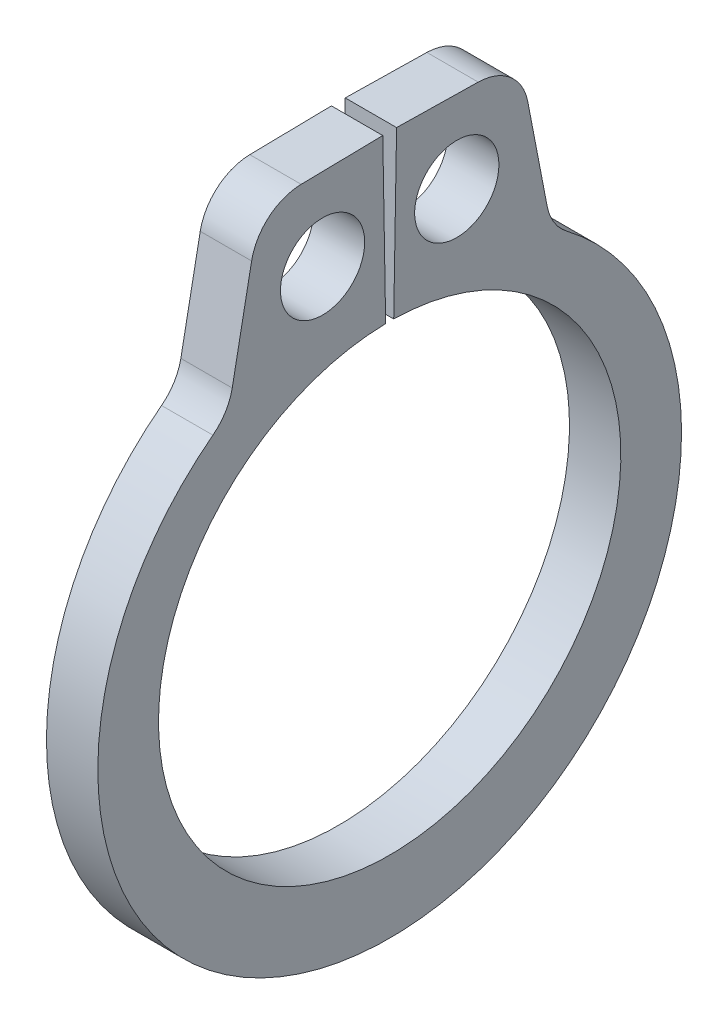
SolidWorks part; units mm, degrees
ref_plane "Front" through (0, 0, 0) normal (0, 0, 1) x (1, 0, 0)
ref_plane "Top" through (0, 0, 0) normal (0, 1, 0) x (1, 0, 0)
ref_plane "Right" through (0, 0, 0) normal (1, 0, 0) x (0, 0, -1)
sketch "Sketch1" plane through (0, 0, 0) normal (1, 0, 0) x (0, 0, -1)
  line L0 (0, 0) -> (0, 2.8575) construction
  line L1 (-0.0499, 2.8571) -> (-0.0853, 4.8888)
  line L2 (0.0853, 4.8888) -> (1.6091, 4.8622)
  line L3 (1.6091, 4.8622) -> (1.9944, 2.867)
  line L4 (0.0499, 2.8571) -> (0.0853, 4.8888)
  line L5 (-0.0853, 4.8888) -> (-1.6091, 4.8622)
  line L6 (-1.6091, 4.8622) -> (-1.9944, 2.867)
  line L7 (-1.9944, 2.867) -> (-1.6318, 2.3457) construction
  line L8 (1.9944, 2.867) -> (1.6318, 2.3457) construction
  line L9 (0, -2.8575) -> (0, -3.7465) construction
  line L10 (-1.6091, 4.8622) -> (-0.0499, 2.8571) construction
  line L11 (0, 2.8575) -> (0, 4.8895) construction
  circle A0 centre (0, 0) radius 2.8575 construction
  arc A1 (-0.0499, 2.8571) -> (0.0499, 2.8571) centre (0, 0) ccw
  circle A3 centre (0, 0) radius 5.588 construction
  circle A4 centre (-0.8295, 3.8596) radius 0.5207
  circle A5 centre (0.8295, 3.8596) radius 0.5207
  arc A6 (-1.9944, 2.867) -> (1.9944, 2.867) centre (0, -0.139) ccw
  point P0 (0, -3.7465)
  dimension "A" = 5.715
  dimension "D2" = 1.524
  dimension "L" = 11.176
  dimension "Hole" = 1.0414
  dimension "Smin" = 0.635
  dimension "Smax" = 0.889
  dimension "H" = 2.032
  dimension "Angle" = 1
extrude "Extrude1" add sketch "Sketch1" along normal mid plane 0.635
fillet "Fillet1" radius 0.635 4 edges at (0, 2.867, 1.9944) (0, 2.867, -1.9944) (0, 4.8622, 1.6091) (0, 4.8622, -1.6091)
sketch "Sketch2" plane through (0, 0, 0) normal (0, 0, 1) x (1, 0, 0)
  line L0 (-2.3527, 0) -> (5.5848, 0)
  line L1 (5.5848, 0) -> (5.5848, -3.175)
  line L2 (-0.3683, -3.175) -> (-2.0987, -3.175)
  line L3 (5.5848, -3.175) -> (0.3683, -3.175)
  line L4 (0.3683, -3.175) -> (0.3683, -2.921)
  line L5 (0.3683, -2.921) -> (-0.3683, -2.921)
  line L6 (-0.3683, -2.921) -> (-0.3683, -3.175)
  line L7 (-0.3683, -3.175) -> (-2.3527, -3.175) construction
  line L8 (-2.3527, -3.175) -> (-2.3527, 0) construction
  line L9 (5.5848, 0) -> (76.391, 0) construction
  line L10 (-2.0987, -3.175) -> (-2.3527, -2.921)
  line L11 (-2.3527, -2.921) -> (-2.3527, 0)
  point P10 (0, -2.921)
  dimension "D1" = 45
  dimension "Dg" = 5.842
  dimension "Ds" = 6.35
  dimension "W" = 0.7366
  dimension "D2" = 7.9375
  dimension "D3" = 1.9844
revolve "Revolve1" [suppressed] add sketch "Sketch2" angle 360 about L9
delete or keep bodies "Body-Delete1" [suppressed] type delete bodies bodies 122
equation "\"D2@Sketch2\" = \"D1@Extrude1\"*12.5"
equation "\"D3@Sketch2\" = \"D2@Sketch2\"/4"
equation "\"D2@Sketch1\" = \"H@Sketch1\"*.75"
